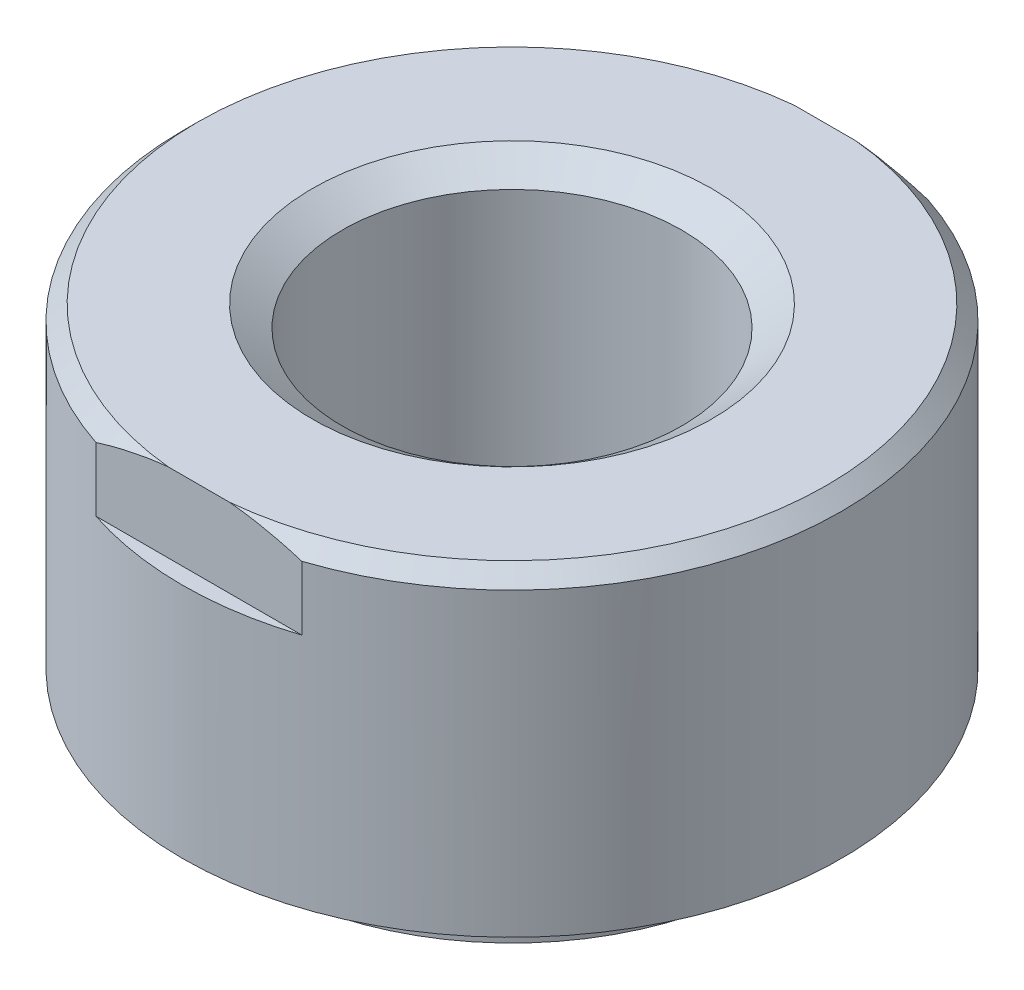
SolidWorks part; units mm, degrees
ref_plane "Plane1" through (0, 0, 0) normal (0, 0, 1) x (1, 0, 0)
ref_plane "Plane2" through (0, 0, 0) normal (0, 1, 0) x (1, 0, 0)
ref_plane "Plane3" through (0, 0, 0) normal (1, 0, 0) x (0, 0, -1)
sketch "BodySke" plane through (0, 0, 0) normal (0, 0, 1) x (1, 0, 0)
  line L0 (5.8956, 0) -> (6.335, 0)
  line L1 (8.25, 0) -> (8.25, 7.9)
  line L2 (8.25, 7.9) -> (4.25, 7.9)
  line L3 (4.25, 7.9) -> (4.25, -1.48)
  line L4 (4.25, -1.48) -> (6.335, -1.48)
  line L5 (6.335, -1.48) -> (6.335, -1.353)
  line L6 (6.335, -1.353) -> (5.8956, -0.592)
  line L7 (1.016, 1.5) -> (3.6522, 1.5) construction
  line L8 (6.335, -0.592) -> (7.2925, -0.592)
  line L9 (0, 0) -> (0, 15.24) construction
  line L10 (5.8956, -0.592) -> (5.8956, 0)
  line L11 (7.2925, -0.592) -> (7.2925, 0)
  line L12 (6.335, -0.592) -> (6.335, 0)
  line L13 (7.2925, 0) -> (8.25, 0)
  dimension "D1" = 60
  dimension "E_dia" = 16.5
  dimension "C_dia" = 12.67
  dimension "A_ht" = 1.48
  dimension "T_ht" = 7.9
  dimension "Thread_min" = 8.5
  dimension "C_len" = 0.127
  dimension "Clinching_ht" = 0.592
  dimension "Advance" = 1.5
  dimension "Clinching_dia" = 14.585
revolve "Body" add sketch "BodySke"
revolve "EndChamfer" cut sketch "EndChamferSke" angle 360 about L0
sketch "EndChamferSke" plane through (0, 0, 0) normal (0, 0, 1) x (1, 0, 0)
  line L0 (0, -2.54) -> (0, 7.62) construction
  line L1 (0, 0) -> (0, 15.24) construction
  line L2 (5, -1.734) -> (5, -1.4775)
  line L3 (5, -1.4775) -> (4.25, -0.9525)
  line L4 (4.25, -0.9525) -> (4.25, -1.734)
  line L5 (4.25, -1.734) -> (5, -1.734)
  line L6 (5, 7.9) -> (4.25, 7.375)
  line L8 (4.25, 7.375) -> (4.25, 7.9)
  line L9 (5, 7.9) -> (4.25, 7.9)
  line L10 (4.25, 7.9) -> (-4.25, 7.9) construction
  line L11 (-6.335, -1.48) -> (6.335, -1.48) construction
  dimension "D1" = 0.254
  dimension "Thread_nominal" = 10
  dimension "D2" = 34.99
  dimension "Thread_min" = 8.5
  dimension "Inset" = 0.0025
chamfer "Chamfer" distance 0.375 1 edges at (0, 7.9, -8.25)
sketch "FlatsSke" plane through (0, 7.9, 0) normal (0, 1, 0) x (-1, 0, 0)
  line L0 (-8.25, 7.8375) -> (8.25, 7.8375)
  line L1 (8.25, 7.8375) -> (8.25, 8.6625)
  line L2 (8.25, 8.6625) -> (-8.25, 8.6625)
  line L3 (-8.25, 8.6625) -> (-8.25, 7.8375)
  line L4 (-8.25, -7.8375) -> (8.25, -7.8375)
  line L5 (8.25, -7.8375) -> (8.25, -8.6625)
  line L6 (8.25, -8.6625) -> (-8.25, -8.6625)
  line L7 (-8.25, -8.6625) -> (-8.25, -7.8375)
  line L8 (0, 9.144) -> (0, -9.144) construction
  line L9 (-9.144, 0) -> (9.144, 0) construction
  dimension "D1" = 16.5
  dimension "D2" = 15.675
  dimension "D3" = 17.325
extrude "Flats" cut sketch "FlatsSke" against normal blind 1.975
ref_plane "Plane4" through (0, -0.5486, 0) normal (0, 1, 0) x (-1, 0, 0)
sketch "ThdSchSke" plane through (0, 0, 0) normal (0, 0, 1) x (1, 0, 0)
  line L0 (0, -5.08) -> (0, 7.62) construction
  line L1 (0, 0) -> (0, 15.24) construction
  line L2 (0, -1.4775) -> (5, -1.4775) construction
  line L4 (5, -1.4775) -> (4.25, -0.9523)
  line L6 (5, -1.4775) -> (4.25, -2.0026)
  line L7 (4.25, -0.9523) -> (4.25, -2.0026)
  line L8 (5, -1.4775) -> (-5, -1.4775) construction
  dimension "Vee_angle" = 70
  dimension "Thread_nominal" = 10
  dimension "Thread_min" = 8.5
revolve "ThreadSchematic" [suppressed] cut sketch "ThdSchSke" angle 360 about L0
pattern_linear "ThdSchPat" [suppressed]
sketch "CliCutSke" plane through (0, -0.592, 0) normal (0, -1, 0) x (1, 0, 0)
  line L0 (0, 0) -> (0, 8.382) construction
  line L1 (0, 0) -> (0.9519, 7.2301) construction
  circle A0 centre (0.9519, 7.2301) radius 0.825
  circle A1 centre (0, 0) radius 7.2925 construction
  dimension "Cut_dia" = 1.65
  dimension "Half_angle" = 7.5
extrude "ClinchingCut" cut sketch "CliCutSke" against normal blind 0.592
pattern_circular "ClinchingCutPat" count 24 every 15 about axis through (0, 0, 0) along (0, 1, 0) of "ClinchingCut"
equation "' \"A_ht@BodySke\" = 1.48"
equation "' \"C_dia@BodySke\" = 12.67"
equation "' \"E_dia@BodySke\" = 16.5"
equation "' \"T_ht@BodySke\" = 7.9"
equation "' \"Advance@BodySke\" = 1.5"
equation "' \"Thread_min@BodySke\" = 8.5"
equation "' \"Thread_nominal@ThreadCosmetic\" = 10"
equation "\"Count@ClinchingCutPat\" = 24"
equation "\"Angle@ClinchingCutPat\" = 360 / \"Count@ClinchingCutPat\""
equation "\"Half_angle@CliCutSke\" = 180 / \"Count@ClinchingCutPat\""
equation "\"Cut_dia@CliCutSke\" = \"E_dia@BodySke\" * 0.1"
equation "\"Clinching_dia@BodySke\" = ( \"E_dia@BodySke\" + \"C_dia@BodySke\" ) /2"
equation "\"Clinching_ht@BodySke\" = \"A_ht@BodySke\" * 0.4"
equation "\"Clinching_ht@ClinchingCut\" =  \"A_ht@BodySke\" * 0.4"
equation "\"D1@FlatsSke\" = \"E_dia@BodySke\""
equation "\"D2@FlatsSke\" = \"E_dia@BodySke\" * 0.95"
equation "\"D3@FlatsSke\" = \"E_dia@BodySke\" * 1.05"
equation "\"Depth@Flats\" = \"T_ht@BodySke\" * 0.25"
equation "\"Width@Chamfer\" = ( \"Thread_nominal@ThreadCosmetic\" - \"Thread_min@BodySke\" ) / 4"
equation "\"Thread_nominal@EndChamferSke\" = \"Thread_nominal@ThreadCosmetic\""
equation "\"Thread_min@EndChamferSke\" = \"Thread_min@BodySke\""
equation "\"D2@EndChamferSke\" = \"Vee_angle@ThdSchSke\" / 2 - 0.01"
equation "\"Thread_nominal@ThdSchSke\" = \"Thread_nominal@ThreadCosmetic\""
equation "\"Thread_min@ThdSchSke\" = \"Thread_min@BodySke\""
equation "\"Num_threads@ThdSchPat\" = int(  ( \"A_ht@BodySke\" + \"T_ht@BodySke\" - \"Inset@EndChamferSke\" ) / \"Advance@BodySke\" + 0.999 )  + 1"
equation "\"Advance@ThdSchPat\" = (  \"A_ht@BodySke\" + \"T_ht@BodySke\" - \"Inset@EndChamferSke\"  ) /  (\"Num_threads@ThdSchPat\" - 1) 'relax it"
